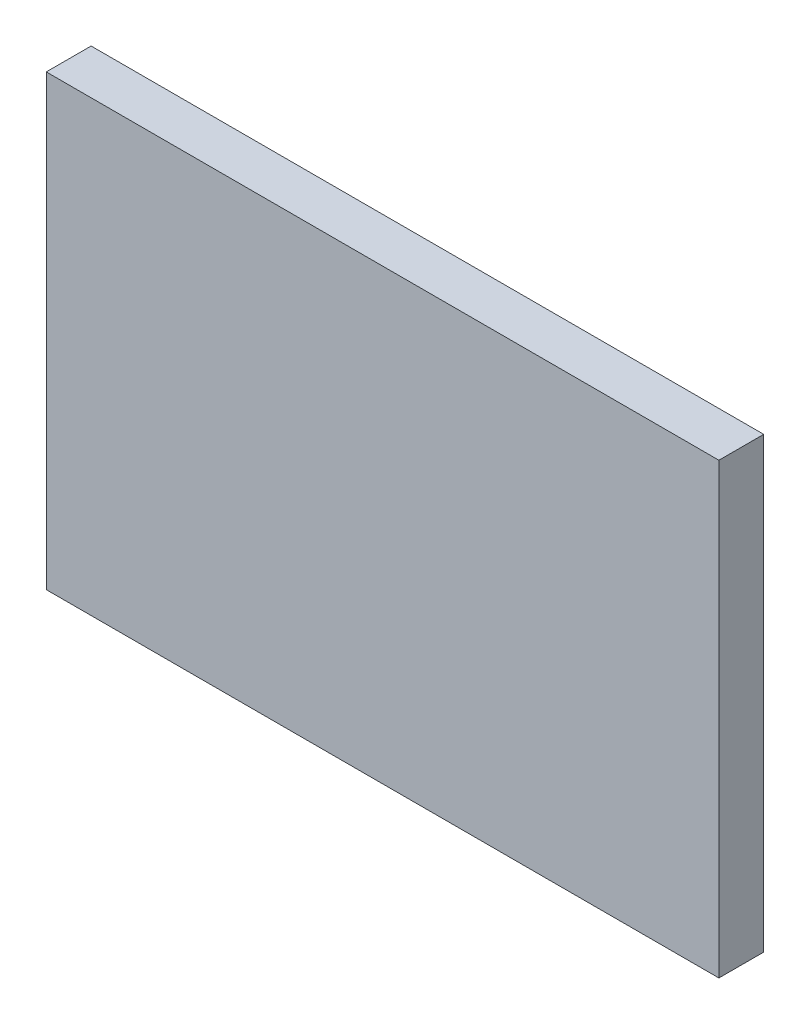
SolidWorks part; units mm, degrees
ref_plane "Front" through (0, 0, 0) normal (0, 0, 1) x (1, 0, 0)
ref_plane "Top" through (0, 0, 0) normal (0, 1, 0) x (1, 0, 0)
ref_plane "Right" through (0, 0, 0) normal (1, 0, 0) x (0, 0, -1)
sketch "Sketch1" plane through (0, 0, 0) normal (0, 0, 1) x (1, 0, 0)
  line L1 (-95.3947, 65.625) -> (54.6053, 65.625)
  line L2 (-95.3947, 65.625) -> (-95.3947, -34.375)
  line L3 (-95.3947, -34.375) -> (54.6053, -34.375)
  line L4 (54.6053, 65.625) -> (54.6053, -34.375)
  dimension "D1" = 150
  dimension "D2" = 100
extrude "Boss-Extrude1" add sketch "Sketch1" along normal blind 10
sketch "Sketch2" [suppressed] plane through (0, 0, 10) normal (0, 0, 1) x (1, 0, 0)
  line L0 (-95.3947, 65.625) -> (-95.3947, -34.375) construction
  line L3 (54.6053, 65.625) -> (-95.3947, 65.625) construction
  circle A0 centre (-20.3947, 15.625) radius 32.5
  dimension "D1" = 65
  dimension "D2" = 50
  dimension "D3" = 75
extrude "Cut-Extrude1" [suppressed] cut sketch "Sketch2" against normal blind 10
sketch "Sketch3" [suppressed] plane through (0, 0, 0) normal (0, 0, -1) x (-1, 0, 0)
  line L0 (-54.6053, -34.375) -> (-54.6053, 65.625) construction
  line L1 (-54.6053, 65.625) -> (95.3947, 65.625) construction
  circle A0 centre (20.3947, 15.625) radius 25
  dimension "D1" = 50
  dimension "D2" = 75
  dimension "D3" = 50
extrude "Cut-Extrude2" [suppressed] cut sketch "Sketch3" against normal blind 10
